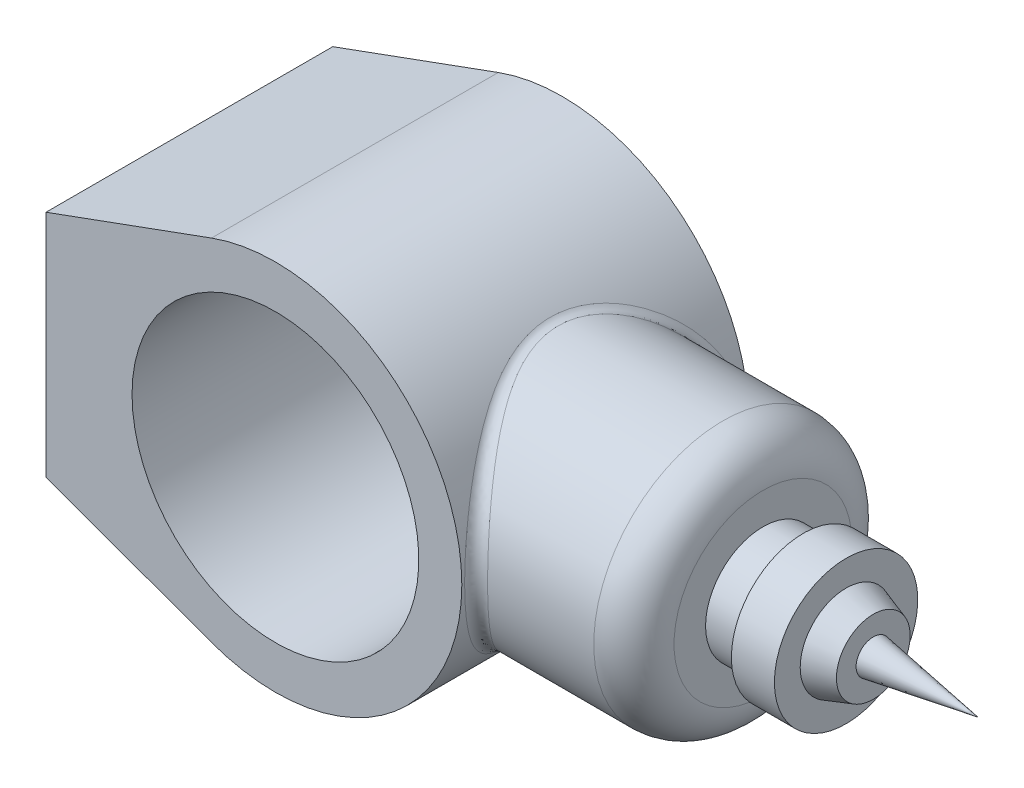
SolidWorks part; units mm, degrees
ref_plane "Front Plane" through (0, 0, 0) normal (0, 0, 1) x (1, 0, 0)
ref_plane "Top Plane" through (0, 0, 0) normal (0, 1, 0) x (1, 0, 0)
ref_plane "Right Plane" through (0, 0, 0) normal (1, 0, 0) x (0, 0, -1)
sketch "Sketch1" plane through (0, 0, 0) normal (0, 0, 1) x (1, 0, 0)
  line L0 (-80, -40) -> (-80, 40)
  line L1 (-80, 40) -> (-22.2817, 61.0617)
  line L2 (-80, -40) -> (-22.2817, -61.0617)
  arc A0 (-22.2817, -61.0617) -> (-22.2817, 61.0617) centre (0, 0) ccw
  circle A1 centre (0, 0) radius 50
  point P8 (-80, 0)
  dimension "D1" = 130
  dimension "D2" = 100
  dimension "D3" = 80
  dimension "D4" = 80
extrude "Boss-Extrude1" add sketch "Sketch1" along normal mid plane 100
ref_plane "Plane1" through (120, 0, 0) normal (1, 0, 0) x (0, 0, -1)
sketch "Sketch2" plane through (120, 0, 0) normal (1, 0, 0) x (0, 0, -1)
  circle A0 centre (0, 0) radius 45
  dimension "D1" = 90
extrude "Boss-Extrude2" add sketch "Sketch2" against normal up to next
sketch "Sketch3" plane through (0, 0, 0) normal (0, 0, 1) x (1, 0, 0)
  line L0 (-119.2154, 0) -> (306.8147, 0) construction
  line L1 (120, 0) -> (120, -20)
  line L2 (120, -55) -> (120, 55) construction
  line L3 (120, -20) -> (134, -20)
  line L4 (134, -20) -> (134, -25)
  line L5 (134, -25) -> (149, -25)
  line L6 (149, -25) -> (149, -16)
  line L7 (149, -16) -> (158.4897, -12.8464)
  line L8 (158.4897, -12.8464) -> (158.4897, -6)
  line L9 (158.4897, -6) -> (195, 0)
  line L10 (195, 0) -> (120, 0)
  point P11 (158.1497, -12.2702)
  dimension "D1" = 20
  dimension "D2" = 14
  dimension "D3" = 15
  dimension "D4" = 10
  dimension "D5" = 37
  dimension "D6" = 5
  dimension "D7" = 75
  dimension "D8" = 9
  dimension "D9" = 6
revolve "Revolve1" add sketch "Sketch3" angle 360 about L0
fillet "Fillet1" radius 4 1 edges at (64.6048, -7.1566, 44.4273)
fillet "Fillet2" radius 14 1 edges at (120, 0, -45)
